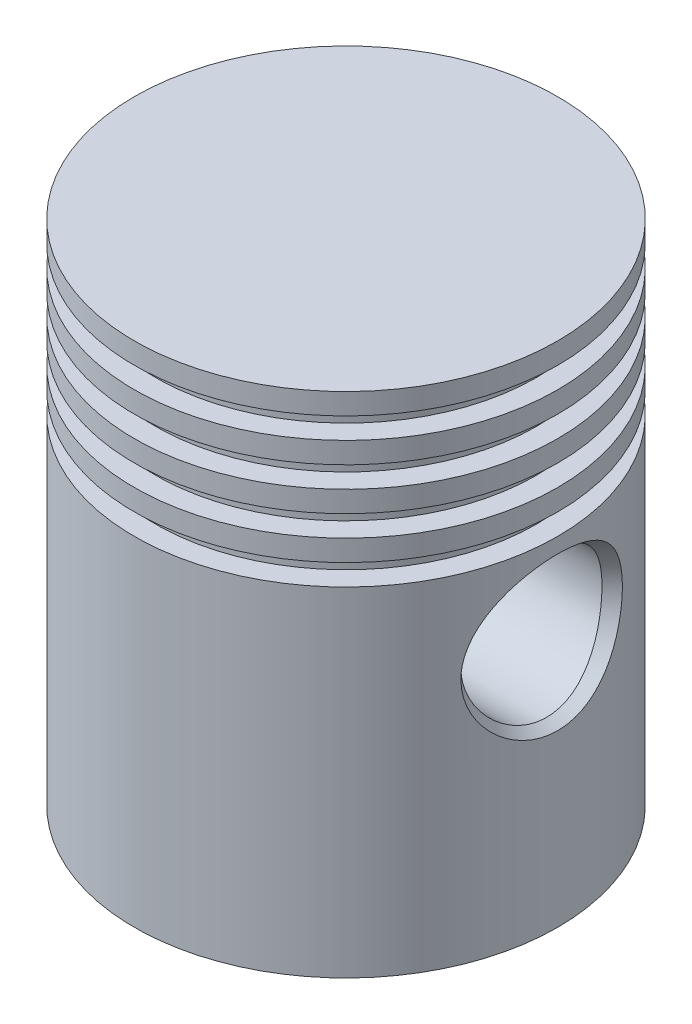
SolidWorks part; units mm, degrees
ref_plane "Front Plane" through (0, 0, 0) normal (0, 0, 1) x (1, 0, 0)
ref_plane "Top Plane" through (0, 0, 0) normal (0, 1, 0) x (1, 0, 0)
ref_plane "Right Plane" through (0, 0, 0) normal (1, 0, 0) x (0, 0, -1)
sketch "Sketch1" plane through (0, 0, 0) normal (0, 0, 1) x (1, 0, 0)
  line L0 (0, 0) -> (0, -72) construction
  line L1 (0, 0) -> (30, 0)
  line L2 (30, 0) -> (30, -3)
  line L3 (30, -3) -> (27, -3)
  line L4 (27, -3) -> (27, -6)
  line L5 (27, -6) -> (30, -6)
  line L6 (30, -6) -> (30, -9)
  line L7 (30, -9) -> (27, -9)
  line L8 (27, -9) -> (27, -12)
  line L9 (27, -12) -> (30, -12)
  line L10 (30, -12) -> (30, -15)
  line L11 (30, -15) -> (27, -15)
  line L12 (27, -15) -> (27, -18)
  line L13 (27, -18) -> (30, -18)
  line L14 (30, -18) -> (30, -21)
  line L15 (30, -21) -> (27, -21)
  line L16 (27, -21) -> (27, -24)
  line L17 (27, -24) -> (30, -24)
  line L18 (30, -24) -> (30, -72)
  line L19 (30, -72) -> (24, -72)
  line L20 (0, 0) -> (0, -12)
  line L21 (0, -12) -> (24, -12)
  line L22 (24, -12) -> (24, -72)
  dimension "D1" = 30
  dimension "D2" = 3
  dimension "D3" = 3
  dimension "D4" = 27
  dimension "D5" = 24
  dimension "D6" = 12
  dimension "D7" = 72
revolve "Revolve1" add sketch "Sketch1" angle 360 about L0
ref_plane "Plane1" through (10, 0, 0) normal (1, 0, 0) x (0, 0, -1)
sketch "Sketch2" plane through (10, 0, 0) normal (1, 0, 0) x (0, 0, -1)
  line L0 (0, -72) -> (0, -37) construction
  line L1 (-24, -72) -> (24, -72) construction
  circle A0 centre (0, -37) radius 13
  point P2 (0, 0)
  dimension "D1" = 26
  dimension "D2" = 35
extrude "Boss-Extrude1" add sketch "Sketch2" along normal up to surface (17.037 mm away)
sketch "Sketch4" plane through (10, 0, 0) normal (1, 0, 0) x (0, 0, -1)
  line L0 (0, -72) -> (0, -37) construction
  line L1 (-30, -72) -> (30, -72) construction
  circle A0 centre (0, -37) radius 10
  point P7 (0, 0)
  dimension "D1" = 20
  dimension "D2" = 35
extrude "Cut-Extrude1" cut sketch "Sketch4" along normal up to surface (18.2843 mm away)
ref_plane "Plane2" through (-10, 0, 0) normal (1, 0, 0) x (0, 0, -1)
sketch "Sketch5" plane through (-10, 0, 0) normal (1, 0, 0) x (0, 0, -1)
  line L0 (0, -72) -> (0, -37) construction
  line L1 (-24, -72) -> (24, -72) construction
  circle A0 centre (0, -37) radius 13
  point P7 (0, 0)
  dimension "D1" = 26
  dimension "D2" = 35
extrude "Boss-Extrude2" add sketch "Sketch5" against normal up to surface (17.037 mm away)
sketch "Sketch6" plane through (-10, 0, 0) normal (1, 0, 0) x (0, 0, -1)
  line L0 (0, -72) -> (0, -37) construction
  line L1 (-24, -72) -> (24, -72) construction
  circle A0 centre (0, -37) radius 10
  point P7 (0, 0)
  dimension "D1" = 20
  dimension "D2" = 35
extrude "Cut-Extrude2" cut sketch "Sketch6" against normal up to surface (18.2843 mm away)
chamfer "Chamfer1" distance 2 angle 45 2 edges at (28.3359, -38.7089, -9.8529) (-28.3359, -35.2911, 9.8529)
